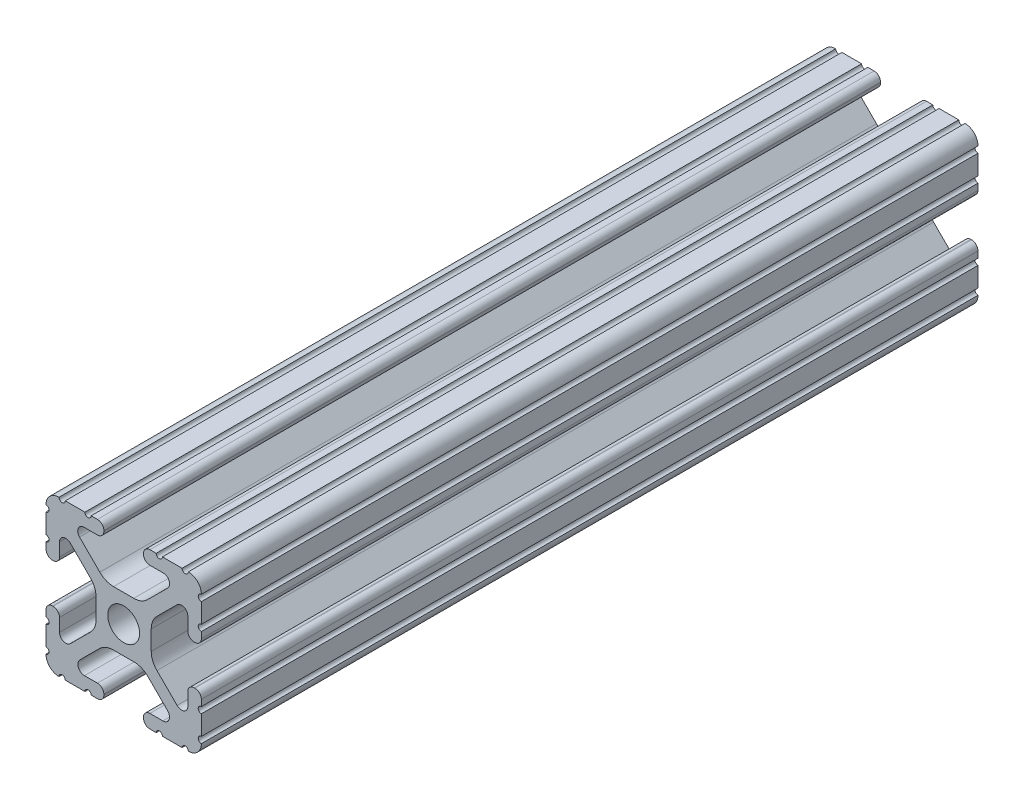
SolidWorks part; units mm, degrees
ref_plane "Front Plane" through (0, 0, 0) normal (0, 0, 1) x (1, 0, 0)
ref_plane "Top Plane" through (0, 0, 0) normal (0, 1, 0) x (1, 0, 0)
ref_plane "Right Plane" through (0, 0, 0) normal (1, 0, 0) x (0, 0, -1)
sketch "Sketch1" plane through (0, 0, 0) normal (0, 0, 1) x (1, 0, 0)
  line L0 (-7.207, 8.7244) -> (-3.8983, 5.4232)
  line L1 (-4.2875, 10.4902) -> (-6.4768, 10.4902)
  line L2 (-3.2385, 11.651) -> (-3.2385, 11.5392)
  line L3 (-5.3171, 12.7) -> (-4.2875, 12.7)
  line L4 (0, 13.4005) -> (0, -14.8534) construction
  line L5 (12.7, 0) -> (-13.9989, 0) construction
  line L6 (-9.5504, 12.7) -> (-6.3331, 12.7)
  line L7 (-12.7, 6.3331) -> (-12.7, 9.5504)
  line L8 (-12.7, 4.2875) -> (-12.7, 5.3171)
  line L9 (-11.5392, 3.2385) -> (-11.651, 3.2385)
  line L10 (-10.4902, 6.4021) -> (-10.4902, 4.2875)
  line L11 (-5.441, 3.8408) -> (-8.7371, 7.1294)
  line L12 (-4.5085, -1.5932) -> (-4.5085, 1.5932)
  line L13 (-1.7093, -4.4958) -> (1.7093, -4.4958)
  line L14 (3.9523, -5.4237) -> (7.1797, -8.6452)
  line L15 (6.4164, -10.4902) -> (4.2875, -10.4902)
  line L16 (3.2385, -11.5392) -> (3.2385, -11.651)
  line L17 (4.2875, -12.7) -> (5.3171, -12.7)
  line L18 (6.3331, -12.7) -> (9.5504, -12.7)
  line L19 (12.7, -9.5504) -> (12.7, -6.3331)
  line L20 (12.7, -5.3171) -> (12.7, -4.2875)
  line L21 (11.651, -3.2385) -> (11.5392, -3.2385)
  line L22 (10.4902, -4.2875) -> (10.4902, -6.4021)
  line L23 (8.7371, -7.1294) -> (5.441, -3.8408)
  line L24 (4.5085, -1.5932) -> (4.5085, 1.5932)
  line L25 (5.441, 3.8408) -> (8.7371, 7.1294)
  line L26 (10.4902, 6.4021) -> (10.4902, 4.2875)
  line L27 (11.5392, 3.2385) -> (11.651, 3.2385)
  line L28 (12.7, 4.2875) -> (12.7, 5.3171)
  line L29 (12.7, 6.3331) -> (12.7, 9.5504)
  line L30 (9.5504, 12.7) -> (6.3331, 12.7)
  line L31 (5.3171, 12.7) -> (4.2875, 12.7)
  line L32 (3.2385, 11.651) -> (3.2385, 11.5392)
  line L33 (4.2875, 10.4902) -> (6.4768, 10.4902)
  line L34 (7.207, 8.7244) -> (3.8983, 5.4232)
  line L35 (1.6558, 4.4958) -> (-1.6558, 4.4958)
  line L36 (-8.7371, -7.1294) -> (-5.441, -3.8408)
  line L37 (-10.4902, -4.2875) -> (-10.4902, -6.4021)
  line L38 (-11.651, -3.2385) -> (-11.5392, -3.2385)
  line L39 (-12.7, -5.3171) -> (-12.7, -4.2875)
  line L40 (-12.7, -9.5504) -> (-12.7, -6.3331)
  line L41 (-6.3331, -12.7) -> (-9.5504, -12.7)
  line L42 (-4.2875, -12.7) -> (-5.3171, -12.7)
  line L43 (-3.2385, -11.5392) -> (-3.2385, -11.651)
  line L44 (-6.4164, -10.4902) -> (-4.2875, -10.4902)
  line L45 (-3.9523, -5.4237) -> (-7.1797, -8.6452)
  arc A0 (-7.207, 8.7244) -> (-6.4768, 10.4902) centre (-6.4768, 9.4563) cw
  arc A1 (-3.2385, 11.5392) -> (-4.2875, 10.4902) centre (-4.2875, 11.5392) cw
  arc A2 (-4.2875, 12.7) -> (-3.2385, 11.651) centre (-4.2875, 11.651) cw
  arc A3 (-5.3171, 12.7) -> (-6.3331, 12.7) centre (-5.8251, 12.7) cw
  arc A4 (-9.5504, 12.7) -> (-10.5664, 12.6998) centre (-10.0584, 12.7) cw
  arc A5 (-12.6998, 10.5664) -> (-10.5664, 12.6998) centre (-10.5918, 10.5918) cw
  arc A6 (-12.6998, 10.5664) -> (-12.7, 9.5504) centre (-12.7, 10.0584) cw
  arc A7 (-12.7, 6.3331) -> (-12.7, 5.3171) centre (-12.7, 5.8251) cw
  arc A8 (-11.651, 3.2385) -> (-12.7, 4.2875) centre (-11.651, 4.2875) cw
  arc A9 (-10.4902, 4.2875) -> (-11.5392, 3.2385) centre (-11.5392, 4.2875) cw
  circle A10 centre (0, 0) radius 2.6035
  arc A11 (-10.4902, 6.4021) -> (-8.7371, 7.1294) centre (-9.4628, 6.4021) cw
  arc A12 (-5.441, 3.8408) -> (-4.5085, 1.5932) centre (-7.6835, 1.5932) cw
  arc A13 (-4.5085, -1.5932) -> (-5.441, -3.8408) centre (-7.6835, -1.5932) cw
  arc A14 (-8.7371, -7.1294) -> (-10.4902, -6.4021) centre (-9.4628, -6.4021) cw
  arc A15 (-1.7093, -4.4958) -> (-3.9523, -5.4237) centre (-1.7093, -7.6708) ccw
  arc A16 (3.9523, -5.4237) -> (1.7093, -4.4958) centre (1.7093, -7.6708) ccw
  arc A17 (6.4164, -10.4902) -> (7.1797, -8.6452) centre (6.4164, -9.4098) ccw
  arc A18 (4.2875, -10.4902) -> (3.2385, -11.5392) centre (4.2875, -11.5392) ccw
  arc A19 (3.2385, -11.651) -> (4.2875, -12.7) centre (4.2875, -11.651) ccw
  arc A20 (6.3331, -12.7) -> (5.3171, -12.7) centre (5.8251, -12.7) ccw
  arc A21 (10.5664, -12.6998) -> (9.5504, -12.7) centre (10.0584, -12.7) ccw
  arc A22 (10.5664, -12.6998) -> (12.6998, -10.5664) centre (10.5918, -10.5918) ccw
  arc A23 (12.7, -9.5504) -> (12.6998, -10.5664) centre (12.7, -10.0584) ccw
  arc A24 (12.7, -5.3171) -> (12.7, -6.3331) centre (12.7, -5.8251) ccw
  arc A25 (12.7, -4.2875) -> (11.651, -3.2385) centre (11.651, -4.2875) ccw
  arc A26 (11.5392, -3.2385) -> (10.4902, -4.2875) centre (11.5392, -4.2875) ccw
  arc A27 (8.7371, -7.1294) -> (10.4902, -6.4021) centre (9.4628, -6.4021) ccw
  arc A28 (4.5085, -1.5932) -> (5.441, -3.8408) centre (7.6835, -1.5932) ccw
  arc A29 (5.441, 3.8408) -> (4.5085, 1.5932) centre (7.6835, 1.5932) ccw
  arc A30 (10.4902, 6.4021) -> (8.7371, 7.1294) centre (9.4628, 6.4021) ccw
  arc A31 (10.4902, 4.2875) -> (11.5392, 3.2385) centre (11.5392, 4.2875) ccw
  arc A32 (11.651, 3.2385) -> (12.7, 4.2875) centre (11.651, 4.2875) ccw
  arc A33 (12.7, 6.3331) -> (12.7, 5.3171) centre (12.7, 5.8251) ccw
  arc A34 (12.6998, 10.5664) -> (12.7, 9.5504) centre (12.7, 10.0584) ccw
  arc A35 (12.6998, 10.5664) -> (10.5664, 12.6998) centre (10.5918, 10.5918) ccw
  arc A36 (9.5504, 12.7) -> (10.5664, 12.6998) centre (10.0584, 12.7) ccw
  arc A37 (5.3171, 12.7) -> (6.3331, 12.7) centre (5.8251, 12.7) ccw
  arc A38 (4.2875, 12.7) -> (3.2385, 11.651) centre (4.2875, 11.651) ccw
  arc A39 (3.2385, 11.5392) -> (4.2875, 10.4902) centre (4.2875, 11.5392) ccw
  arc A40 (7.207, 8.7244) -> (6.4768, 10.4902) centre (6.4768, 9.4563) ccw
  arc A41 (1.6558, 4.4958) -> (3.8983, 5.4232) centre (1.6558, 7.6708) ccw
  arc A42 (-1.6558, 4.4958) -> (-3.8983, 5.4232) centre (-1.6558, 7.6708) cw
  arc A43 (-11.5392, -3.2385) -> (-10.4902, -4.2875) centre (-11.5392, -4.2875) cw
  arc A44 (-12.7, -4.2875) -> (-11.651, -3.2385) centre (-11.651, -4.2875) cw
  arc A45 (-12.7, -5.3171) -> (-12.7, -6.3331) centre (-12.7, -5.8251) cw
  arc A46 (-12.7, -9.5504) -> (-12.6998, -10.5664) centre (-12.7, -10.0584) cw
  arc A47 (-10.5664, -12.6998) -> (-12.6998, -10.5664) centre (-10.5918, -10.5918) cw
  arc A48 (-10.5664, -12.6998) -> (-9.5504, -12.7) centre (-10.0584, -12.7) cw
  arc A49 (-6.3331, -12.7) -> (-5.3171, -12.7) centre (-5.8251, -12.7) cw
  arc A50 (-3.2385, -11.651) -> (-4.2875, -12.7) centre (-4.2875, -11.651) cw
  arc A51 (-4.2875, -10.4902) -> (-3.2385, -11.5392) centre (-4.2875, -11.5392) cw
  arc A52 (-6.4164, -10.4902) -> (-7.1797, -8.6452) centre (-6.4164, -9.4098) cw
  dimension "D1" = 5.207
  dimension "D9" = 14.859
  dimension "D2" = 25.4
  dimension "D3" = 12.7
  dimension "D4" = 6.477
  dimension "D5" = 8.2042
  dimension "D6" = 9.017
  dimension "D8" = 2.2098
  dimension "D10" = 2.2098
extrude "Extrude1" add sketch "Sketch1" against normal blind 127
